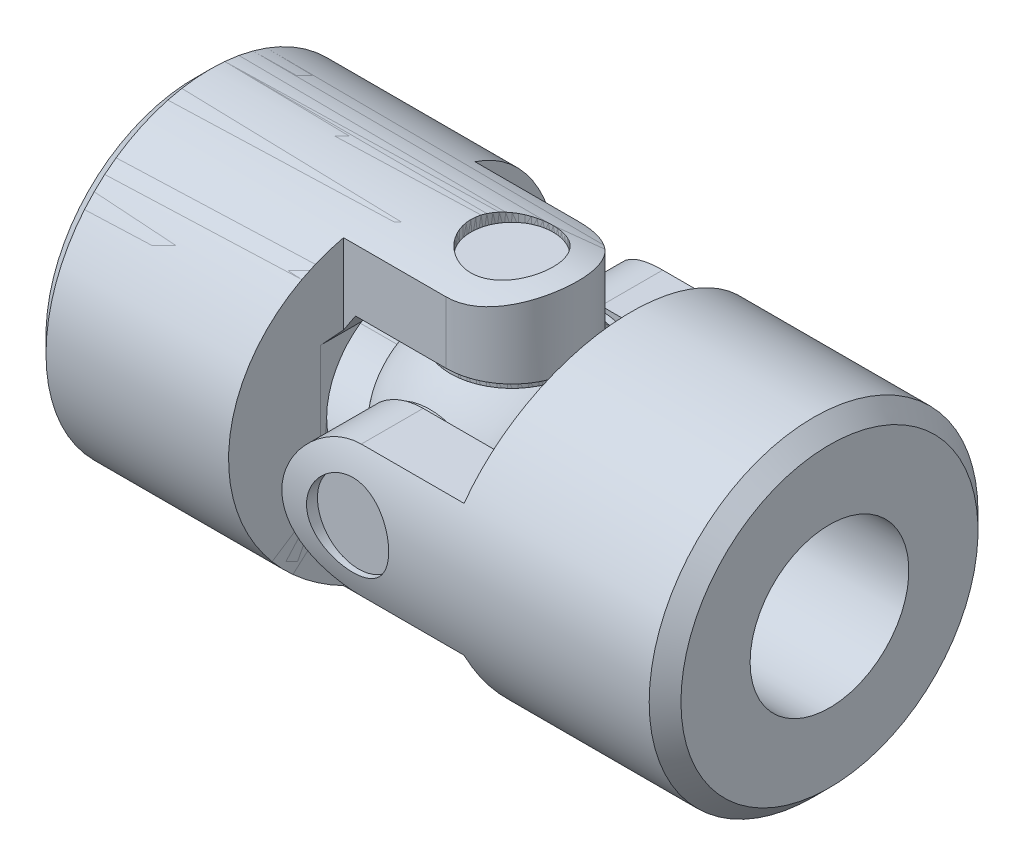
SolidWorks part; units mm, degrees
ref_plane "Ebene vorne" through (0, 0, 0) normal (0, 0, 1) x (1, 0, 0)
ref_plane "Ebene oben" through (0, 0, 0) normal (0, 1, 0) x (1, 0, 0)
ref_plane "Ebene rechts" through (0, 0, 0) normal (1, 0, 0) x (0, 0, -1)
imported_body "Importiert1"
sketch "Skizze1" plane through (0, 0, 0) normal (0, 0, 1) x (1, 0, 0)
  line L0 (54.6, 14.5) -> (38.5, 14.5) construction
  line L1 (54.6, 14.5) -> (38.5, 14.5)
  line L2 (38.5, -14.5) -> (54.6, -14.5) construction
  line L3 (38.5, -14.5) -> (54.6, -14.5)
  line L4 (56, 13.1) -> (54.6, 14.5) construction
  line L5 (56, 13.1) -> (54.6, 14.5)
  line L6 (54.6, -14.5) -> (56, -13.1) construction
  line L7 (54.6, -14.5) -> (56, -13.1)
  line L8 (56, -13.1) -> (56, 13.1) construction
  line L9 (56, -13.1) -> (56, 13.1)
  line L10 (38.5, 14.5) -> (37.0625, 5.8) construction
  line L11 (38.5, 14.5) -> (37.0625, 5.8)
  line L12 (37.0625, -5.8) -> (38.5, -14.5) construction
  line L13 (37.0625, -5.8) -> (38.5, -14.5)
  line L14 (37.0625, 5.8) -> (28, 5.8) construction
  line L15 (37.0625, 5.8) -> (34.9634, 5.8)
  line L17 (37.0625, -5.8) -> (34.9634, -5.8)
  line L18 (22.5625, 7.25) -> (33.4375, 7.25) construction
  line L19 (22.5625, 7.25) -> (33.4375, 7.25)
  line L20 (22.5625, 7.8378) -> (22.5625, 7.25) construction
  line L21 (28, -5.8) -> (37.0625, -5.8) construction
  line L22 (22.5625, -7.25) -> (33.4375, -7.25) construction
  line L23 (22.5625, -7.25) -> (33.4375, -7.25)
  arc A2 (22.5625, 7.25) -> (22.5625, -7.25) centre (28, 0) ccw
  arc A3 (34.9634, 5.8) -> (33.4375, 7.25) centre (28, 0) ccw
  arc A4 (33.4375, -7.25) -> (34.9634, -5.8) centre (28, 0) ccw
extrude "Schnitt-Linear austragen1" cut sketch "Skizze1" against normal mid plane 103
sketch "Skizze2" plane through (0, 13.5333, 0) normal (0, 1, 0) x (-1, 0, 0)
  circle A0 centre (-28, 0) radius 3.625 construction
  circle A1 centre (-28, 0) radius 3.625
extrude "Schnitt-Linear austragen2" cut sketch "Skizze2" against normal through all
